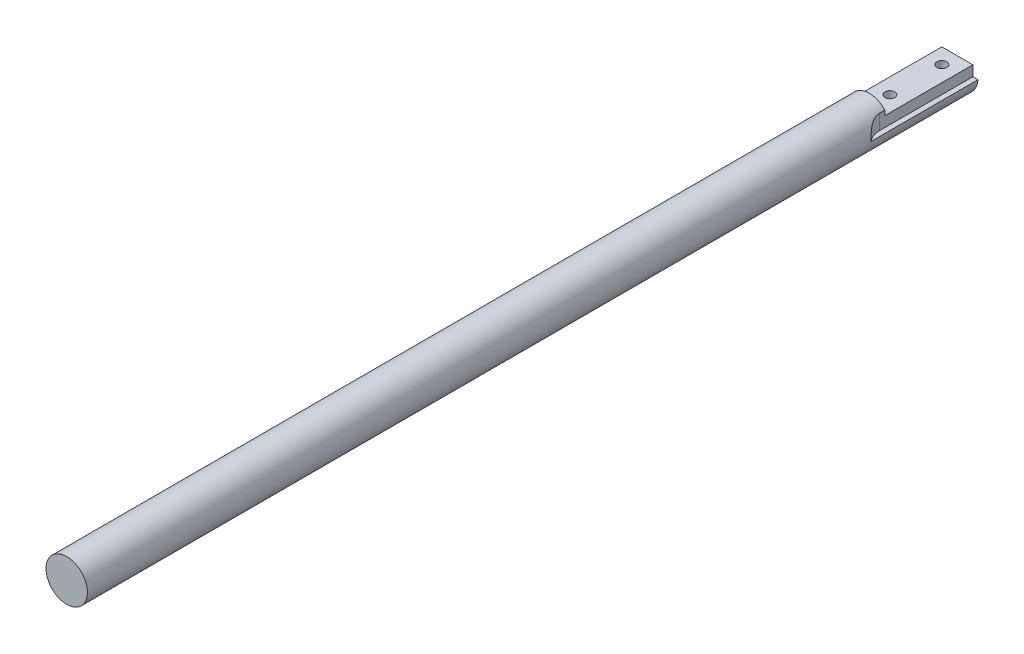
SolidWorks part; units mm, degrees
ref_plane "Front" through (0, 0, 0) normal (0, 0, 1) x (1, 0, 0)
ref_plane "Top" through (0, 0, 0) normal (0, 1, 0) x (1, 0, 0)
ref_plane "Right" through (0, 0, 0) normal (1, 0, 0) x (0, 0, -1)
sketch "Sketch1" plane through (0, 0, 0) normal (0, 0, -1) x (-1, 0, 0)
  circle A1 centre (0, 0) radius 3.175
extrude "Extrude1" add sketch "Sketch1" against normal blind 136.525
sketch "Sketch3" plane through (0, 0, 0) normal (0, 0, -1) x (-1, 0, 0)
  line L0 (12.0332, -0.1984) -> (2.3812, -0.1984) construction
  line L1 (2.3812, 1.3891) -> (2.3812, -0.1984) construction
  line L2 (-2.3813, 1.3891) -> (2.3812, 1.3891) construction
  line L3 (-2.3813, -0.1984) -> (-2.3813, 1.3891) construction
  line L4 (-2.3813, -0.1984) -> (-4.6355, -0.1984) construction
  line L5 (4.8895, -0.1984) -> (2.3812, -0.1984)
  line L6 (2.3812, 1.3891) -> (2.3812, -0.1984)
  line L7 (-2.3813, 1.3891) -> (2.3812, 1.3891)
  line L8 (-2.3813, -0.1984) -> (-2.3813, 1.3891)
  line L9 (-2.3813, -0.1984) -> (-4.6355, -0.1984)
  line L10 (-4.6355, -0.1984) -> (-4.6355, 4.5641)
  line L11 (-4.6355, 4.5641) -> (4.8895, 4.5641)
  line L12 (4.8895, 4.5641) -> (4.8895, -0.1984)
  dimension "D1" = 9.525
  dimension "D2" = 4.7625
extrude "Cut-Extrude1" cut sketch "Sketch3" against normal blind 13.4937
sketch "Sketch4" plane through (0, -0.1984, 0) normal (0, 1, 0) x (-1, 0, 0)
  line L0 (0, 0) -> (0, 7.063) construction
  line L1 (-2.3813, 11.1125) -> (-8.7313, 11.1125)
  line L2 (-2.3813, 11.1125) -> (-2.3813, 14.2875)
  line L3 (-5.5563, 17.4625) -> (-8.7313, 17.4625)
  line L4 (-8.7313, 11.1125) -> (-8.7313, 17.4625)
  line L5 (-2.3813, 13.4937) -> (-2.3813, 0) construction
  line L6 (-2.3813, 13.4937) -> (2.3812, 13.4937) construction
  line L7 (8.7313, 11.1125) -> (8.7313, 17.4625)
  line L8 (5.5563, 17.4625) -> (8.7313, 17.4625)
  line L9 (2.3813, 11.1125) -> (2.3813, 14.2875)
  line L10 (2.3813, 11.1125) -> (8.7313, 11.1125)
  arc A0 (-2.3813, 14.2875) -> (-5.5563, 17.4625) centre (-5.5563, 14.2875) ccw
  arc A1 (2.3813, 14.2875) -> (5.5563, 17.4625) centre (5.5563, 14.2875) cw
  point P13 (-2.3813, 17.4625)
  dimension "D3" = 3.175
  dimension "D1" = 6.35
  dimension "D2" = 6.35
  dimension "D4" = 0.7937
extrude "Cut-Extrude2" cut sketch "Sketch4" along normal through all
hole_wizard "#0-80 Tapped Hole1" positions "Sketch6" profile "Sketch5" tap size "#0-80" standard "Ansi Inch"
sketch "Sketch6" plane through (0, 1.3891, 0) normal (0, 1, 0) x (-1, 0, 0)
  point P0 (0.0036, 10.3378)
  point P1 (0.0159, 2.3622)
sketch "Sketch5" plane through (-0.0036, 1.3891, 10.3378) normal (1, 0, 0) x (0, 0, 1)
  line L0 (0, 0) -> (0, 4.5641)
  line L1 (0, 4.5641) -> (0.762, 4.5641)
  line L2 (0.762, 4.5641) -> (0.762, 0)
  line L5 (0.762, 0) -> (0, 0)
  line L11 (0, -6.35) -> (0, 107.95) construction
  dimension "Thread Major Dia." = 1.524
  dimension "Thru Tap Drill Depth" = 4.5641
